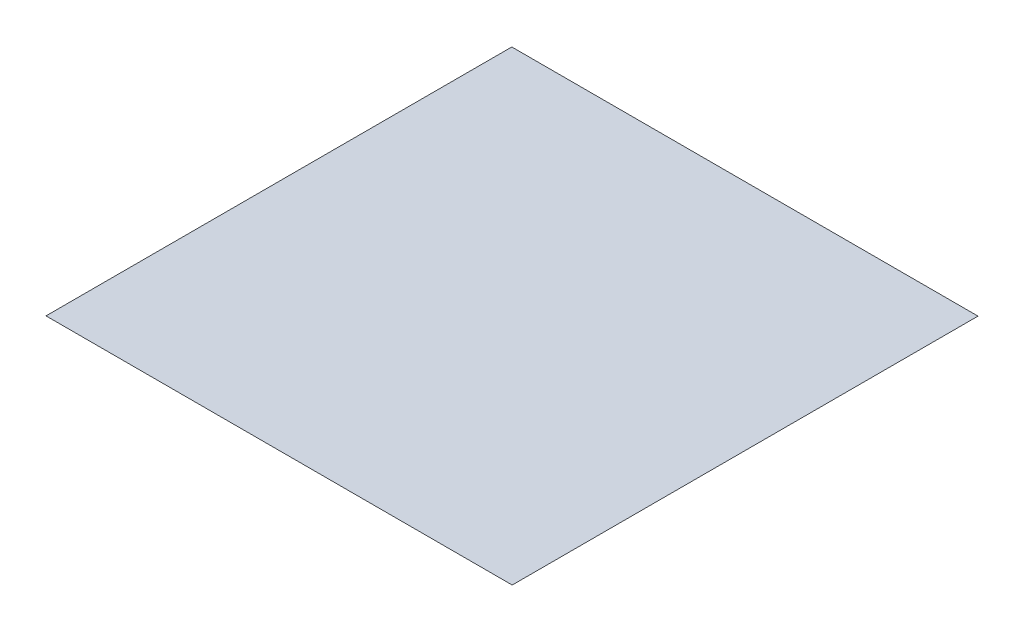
SolidWorks part; units mm, degrees
ref_plane "Front Plane" through (0, 0, 0) normal (0, 0, 1) x (1, 0, 0)
ref_plane "Top Plane" through (0, 0, 0) normal (0, 1, 0) x (1, 0, 0)
ref_plane "Right Plane" through (0, 0, 0) normal (1, 0, 0) x (0, 0, -1)
ref_plane "Plane1" through (0, 355.6, 0) normal (0, 1, 0) x (-1, 0, 0)
ref_plane "Plane2" through (0, 1.5914, 1.5787) normal (0, 0.7099, 0.7043) x (-1, 0, 0)
ref_plane "Plane3" through (0, 0, 0) normal (0.7071, 0.7071, 0) x (-0.7071, 0.7071, 0)
ref_plane "Plane4" through (0, 1.5914, -1.5787) normal (0, 0.7099, -0.7043) x (-1, 0, 0)
ref_plane "Plane5" through (0, 0, 0) normal (-0.7071, 0.7071, 0) x (-0.7071, -0.7071, 0)
sketch "Sketch5" plane through (0, 355.6, 0) normal (0, 1, 0) x (-1, 0, 0)
  line L1 (553.1775, -542.551) -> (-503.124, -542.551)
  line L2 (553.1775, -542.551) -> (553.1775, 509.7355)
  line L3 (553.1775, 509.7355) -> (-503.124, 509.7355)
  line L4 (-503.124, -542.551) -> (-503.124, 509.7355)
extrude "Extrude1" add sketch "Sketch5" against normal blind 441.706 separate body
other "SurfaceCut1"
other "SurfaceCut2"
other "SurfaceCut3"
other "SurfaceCut4"
sketch "Sketch8" plane through (0, 0, 0) normal (0, 0, 1) x (1, 0, 0)
  line L0 (-304.8, 304.8) -> (304.8, 304.8) construction
  line L1 (212.7795, -212.7795) -> (-212.7795, 212.7795) construction
  line L2 (212.7795, 212.7795) -> (-212.7795, -212.7795) construction
  line L3 (-139.8112, 304.8) -> (-139.8112, 355.6) construction
  line L4 (390.8119, 355.6) -> (-390.8119, 355.6) construction
  dimension "D1" = 609.6
